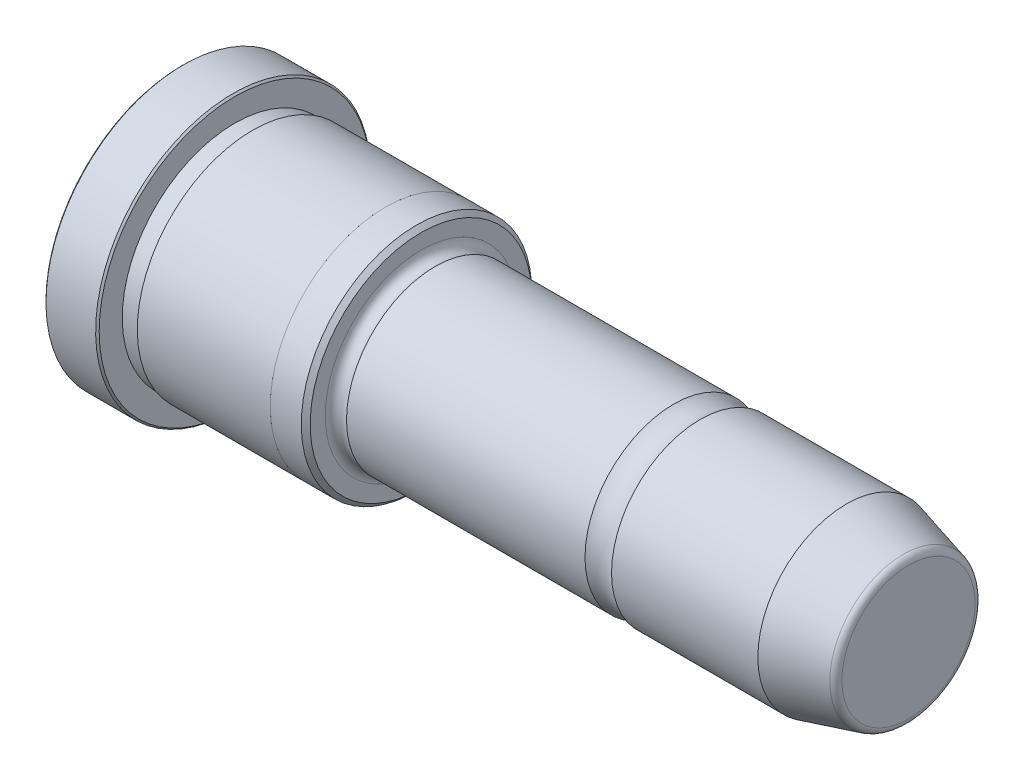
SolidWorks part; units mm, degrees
ref_plane "Front Plane" through (0, 0, 0) normal (0, 0, 1) x (1, 0, 0)
ref_plane "Top Plane" through (0, 0, 0) normal (0, 1, 0) x (1, 0, 0)
ref_plane "Right Plane" through (0, 0, 0) normal (1, 0, 0) x (0, 0, -1)
sketch "Sketch1" plane through (0, 0, 0) normal (0, 0, 1) x (1, 0, 0)
  line L0 (55, 8.1244) -> (48, 10)
  line L1 (48, 10) -> (1.6, 10)
  line L2 (0, 10.8) -> (0, 13)
  line L3 (0, 13) -> (-4, 13)
  line L4 (-19, 13.001) -> (-19, 12.7)
  line L5 (-19, 12.7) -> (-21, 12.7)
  line L6 (-21, 12.7) -> (-21, 15.5)
  line L7 (-21, 15.5) -> (-27, 15.5)
  line L8 (-27, 15.5) -> (-27, 0)
  line L9 (-19, 13.001) -> (-4, 13.001)
  line L10 (-4, 13.001) -> (-4, 13)
  line L13 (55, 8.1244) -> (55, 0)
  line L14 (55, 0) -> (-55, 0) construction
  line L15 (55, 0) -> (-27, 0)
  arc A0 (0, 10.8) -> (1.6, 10) centre (1, 10.8) ccw
  point P16 (0, 0)
  dimension "ShoulderRadii" = 2
  dimension "D1" = 15
  dimension "D2" = 0.3
  dimension "PinDia" = 20
  dimension "ChamferLeadIn" = 7
  dimension "ShoulderDia" = 26
  dimension "PinLengthN" = 55
  dimension "ShoulderLength" = 27
  dimension "D3" = 4
  dimension "ShoulderGap" = 2
  dimension "D4" = 0.001
  dimension "T" = 6
  dimension "HeadDia" = 31
  dimension "D8" = 0.2
revolve "Revolve1" add sketch "Sketch1" angle 360 about L14
sketch "Sketch2" plane through (0, 0, 0) normal (0, 0, 1) x (1, 0, 0)
  line L0 (55, -8.1244) -> (55, 8.1244) construction
  line L1 (1.6, 9.6) -> (48, 9.6) construction
  line L2 (48, 10) -> (1.6, 10) construction
  line L3 (1.6, 10) -> (1.6, -10) construction
  line L4 (28.5033, 10) -> (31.4967, 10)
  line L5 (48, 10) -> (48, -10) construction
  arc A0 (28.5033, 10) -> (31.4967, 10) centre (30, 12.6) ccw
  dimension "GrooveRadius" = 3
  dimension "D3" = 0.4
  dimension "AGroove" = 25
revolve "Groove A" cut sketch "Sketch2" angle 360 about axis through (55, 0, 0) along (1, 0, 0)
sketch "Sketch3" plane through (0, 0, 0) normal (0, 0, 1) x (1, 0, 0)
  line L3 (28.5033, 10) -> (31.4967, 10)
  arc A0 (28.5033, 10) -> (31.4967, 10) centre (30, 12.6) ccw
  arc A1 (28.5033, 10) -> (31.4967, 10) centre (30, 12.6) ccw construction
  dimension "D1" = 0.4
  dimension "GroovePitch" = 0
revolve "Groove B" [suppressed] cut sketch "Sketch3" angle 360
sketch "Sketch4" [suppressed] plane through (0, 0, 0) normal (0, 0, 1) x (1, 0, 0)
  line L2 (56.5033, 10) -> (1.6, 10) construction
  line L3 (24.5033, 10) -> (27.4967, 10)
  arc A0 (24.5033, 10) -> (27.4967, 10) centre (26, 12.6) ccw
  arc A3 (56.5033, 10) -> (59.4967, 10) centre (58, 12.6) ccw construction
  dimension "D1" = 0.4
revolve "Groove C" [suppressed] cut sketch "Sketch4" angle 360
sketch "Sketch5" [suppressed] plane through (0, 0, 0) normal (0, 0, 1) x (1, 0, 0)
  line L0 (24.5033, 10) -> (27.4967, 10)
  line L1 (62.5033, 10) -> (1.6, 10) construction
  arc A0 (24.5033, 10) -> (27.4967, 10) centre (26, 12.6) ccw
  arc A3 (62.5033, 10) -> (65.4967, 10) centre (64, 12.6) ccw construction
  dimension "D1" = 0.4
revolve "Groove D" [suppressed] cut sketch "Sketch5" angle 360
fillet "Fillet1" radius 0.8 1 edges at (55, 8.1244, 0)
chamfer "Chamfer1" distance 0.2 angle 45 2 edges at (-27, 15.5, 0) (-21, 15.5, 0)
chamfer "Chamfer2" distance 0.5 angle 45 1 edges at (0, 13, 0)
